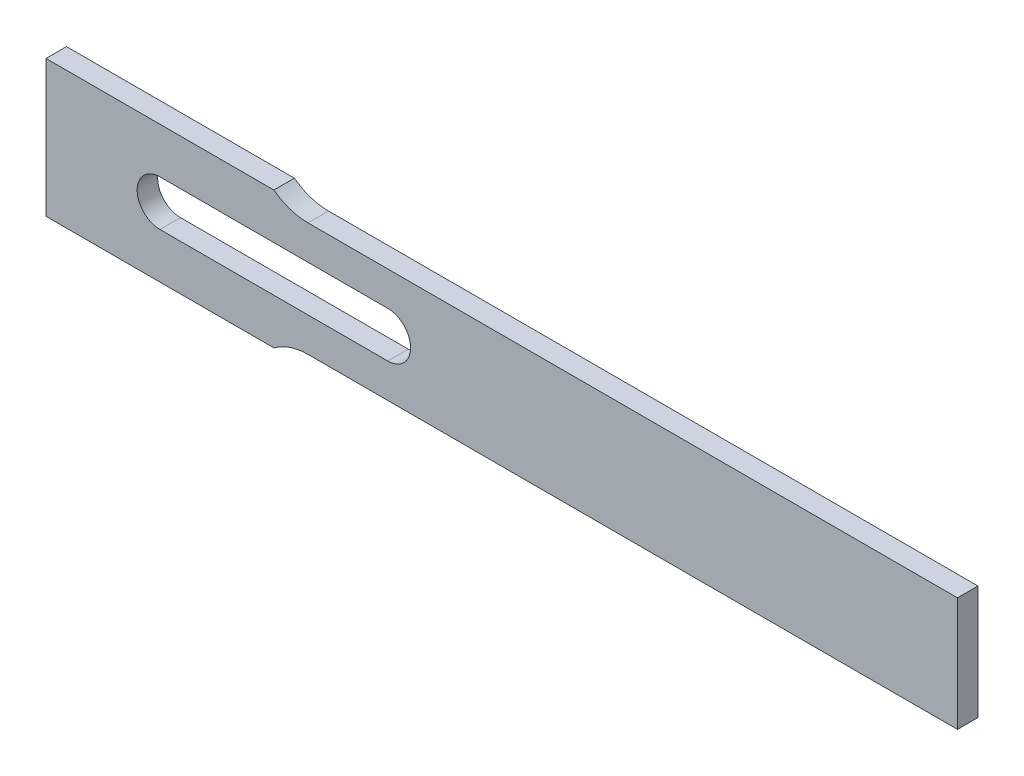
SolidWorks part; units mm, degrees
ref_plane "Front Plane" through (0, 0, 0) normal (0, 0, 1) x (1, 0, 0)
ref_plane "Top Plane" through (0, 0, 0) normal (0, 1, 0) x (1, 0, 0)
ref_plane "Right Plane" through (0, 0, 0) normal (1, 0, 0) x (0, 0, -1)
sketch "Sketch1" plane through (0, 0, 0) normal (0, 0, 1) x (1, 0, 0)
  line L0 (0, 0) -> (211.3366, 0) construction
  line L1 (0, 0) -> (0, 78.9562) construction
  line L2 (80, 5) -> (23, 5)
  line L3 (0, -6) -> (20, -6)
  line L4 (0, -6) -> (0, 6)
  line L5 (0, 6) -> (20, 6)
  line L6 (80, -5) -> (80, 5)
  line L7 (80, -5) -> (23, -5)
  arc A0 (20, 6) -> (23, 5) centre (23, 10) ccw
  arc A1 (23, -5) -> (20, -6) centre (23, -10) ccw
  dimension "D7" = 5
  dimension "D8" = 5
  dimension "D1" = 80
  dimension "D2" = 12
  dimension "D3" = 6
  dimension "D4" = 10
  dimension "D5" = 5
  dimension "D6" = 20
extrude "Extrude1" add sketch "Sketch1" along normal blind 1.8
sketch "Sketch2" plane through (0, 0, 0) normal (0, 0, 1) x (1, 0, 0)
  line L0 (0, 0) -> (84.3147, 0) construction
  line L1 (0, 6) -> (0, -6) construction
  line L2 (10, -2) -> (30, -2)
  line L4 (10, 2) -> (30, 2)
  arc A0 (10, 2) -> (10, -2) centre (10, 0) ccw
  arc A1 (30, -2) -> (30, 2) centre (30, 0) ccw
  dimension "D1" = 20
  dimension "D2" = 10
  dimension "D3" = 4
  dimension "D4" = 2
extrude "Extrude2" cut sketch "Sketch2" along normal through all
